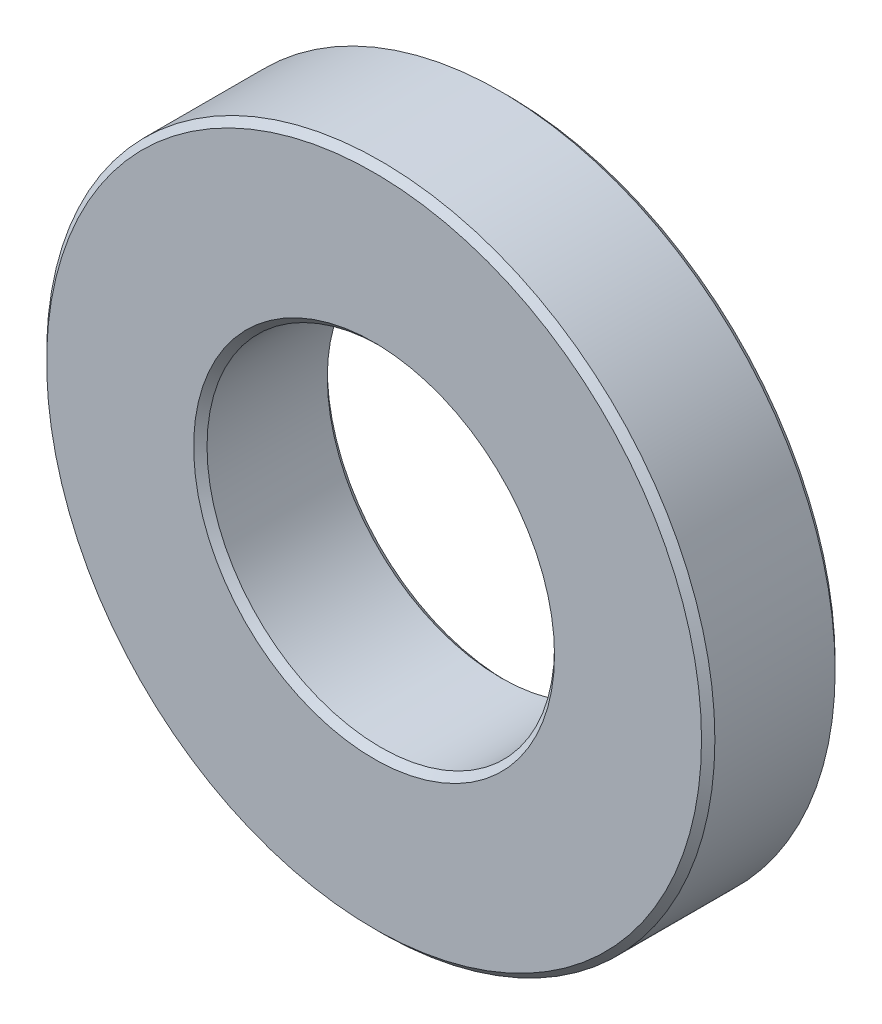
SolidWorks part; units mm, degrees
ref_plane "Front Plane" through (0, 0, 0) normal (0, 0, 1) x (1, 0, 0)
ref_plane "Top Plane" through (0, 0, 0) normal (0, 1, 0) x (1, 0, 0)
ref_plane "Right Plane" through (0, 0, 0) normal (1, 0, 0) x (0, 0, -1)
sketch "Sketch1" plane through (0, 0, 0) normal (0, 0, 1) x (1, 0, 0)
  circle A0 centre (0, 0) radius 5
  circle A1 centre (0, 0) radius 2.6
  dimension "D1" = 10
  dimension "D2" = 5.2
extrude "Boss-Extrude2" add sketch "Sketch1" along normal mid plane 2
chamfer "Chamfer3" distance 0.1 angle 45 4 edges at (5, 0, 1) (5, 0, -1) (2.6, 0, -1) (2.6, 0, 1)
